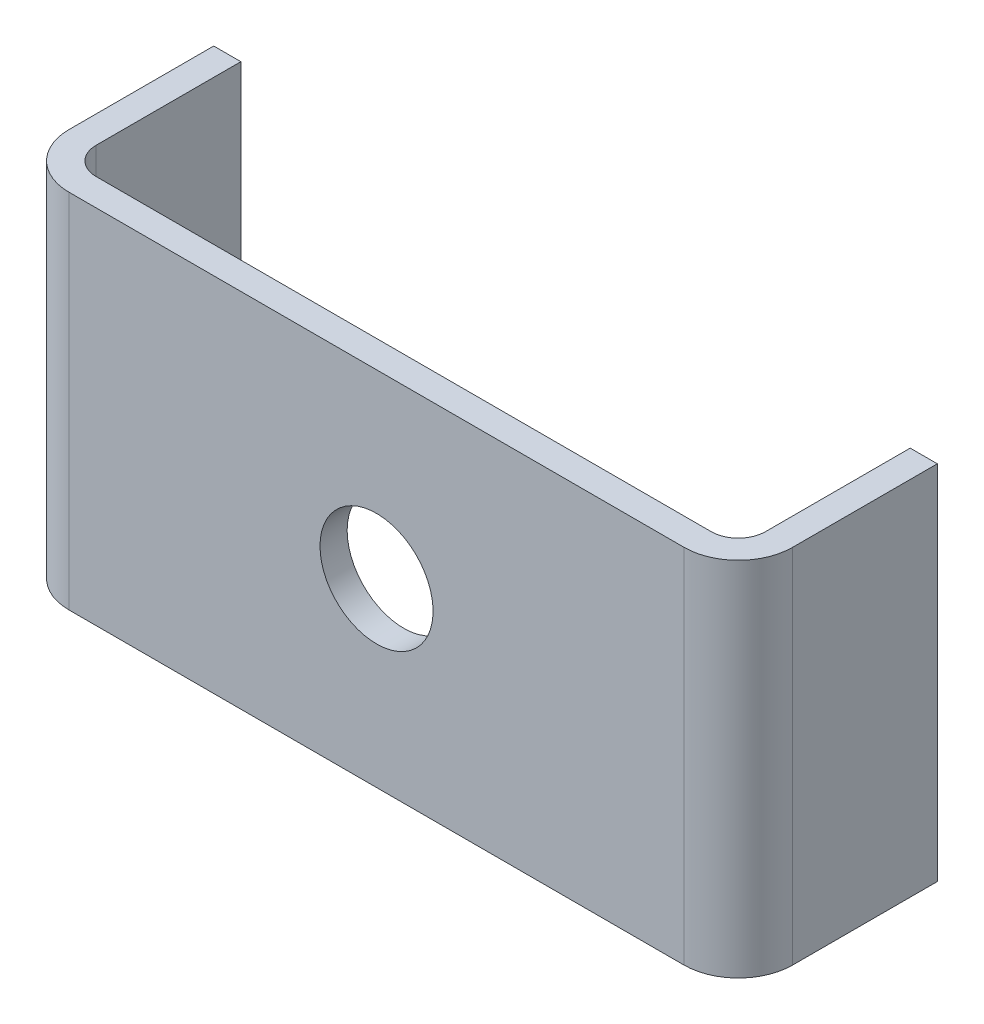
SolidWorks part; units mm, degrees
ref_plane "Plan de face" through (0, 0, 0) normal (0, 0, 1) x (1, 0, 0)
ref_plane "Plan de dessus" through (0, 0, 0) normal (0, 1, 0) x (1, 0, 0)
ref_plane "Plan de droite" through (0, 0, 0) normal (1, 0, 0) x (0, 0, -1)
ref_plane "Plan1" through (0, 0, -22) normal (0, 0, -1) x (-1, 0, 0)
sketch "Esquisse1" plane through (0, 0, -22) normal (0, 0, -1) x (-1, 0, 0)
  line L0 (40, -20) -> (40, 20)
  line L1 (40, 20) -> (-40, 20)
  line L2 (-40, 20) -> (-40, -20)
  line L3 (-40, -20) -> (40, -20)
extrude "Boss.-Extru.1" add sketch "Esquisse1" against normal blind 22
sketch "Esquisse2" plane through (0, -20, 0) normal (0, -1, 0) x (1, 0, 0)
  line L0 (37, -22) -> (37, -3)
  line L1 (37, -3) -> (-37, -3)
  line L2 (-37, -3) -> (-37, -22)
  line L3 (-37, -22) -> (37, -22)
extrude "Enlèv. mat.-Extru.1" cut sketch "Esquisse2" against normal through all
hole_wizard "Diamètre du perçage Ø12.5 (12.5)1" positions "Esquisse4" profile "Esquisse3" hole size "Ø12.5" standard "Ansi Metric"
sketch "Esquisse4" plane through (0, 0, -3) normal (0, 0, -1) x (-1, 0, 0)
  point P0 (0, 0)
sketch "Esquisse3" plane through (0, 0, -3) normal (1, 0, 0) x (0, 1, 0)
  line L0 (0, 0) -> (0, 3)
  line L1 (0, 3) -> (6.25, 3)
  line L2 (6.25, 3) -> (6.25, 0)
  line L5 (6.25, 0) -> (0, 0)
  line L11 (0, -6.35) -> (0, 107.95) construction
  dimension "Diamètre du perçage jusqu'au prochain" = 12.5
  dimension "Profondeur du perçage jusqu'au prochain" = 3
fillet "Congé1" radius 3 2 edges at (37, 0, -3) (-37, 0, -3)
fillet "Congé2" radius 6 2 edges at (-40, 0, 0) (40, 0, 0)
